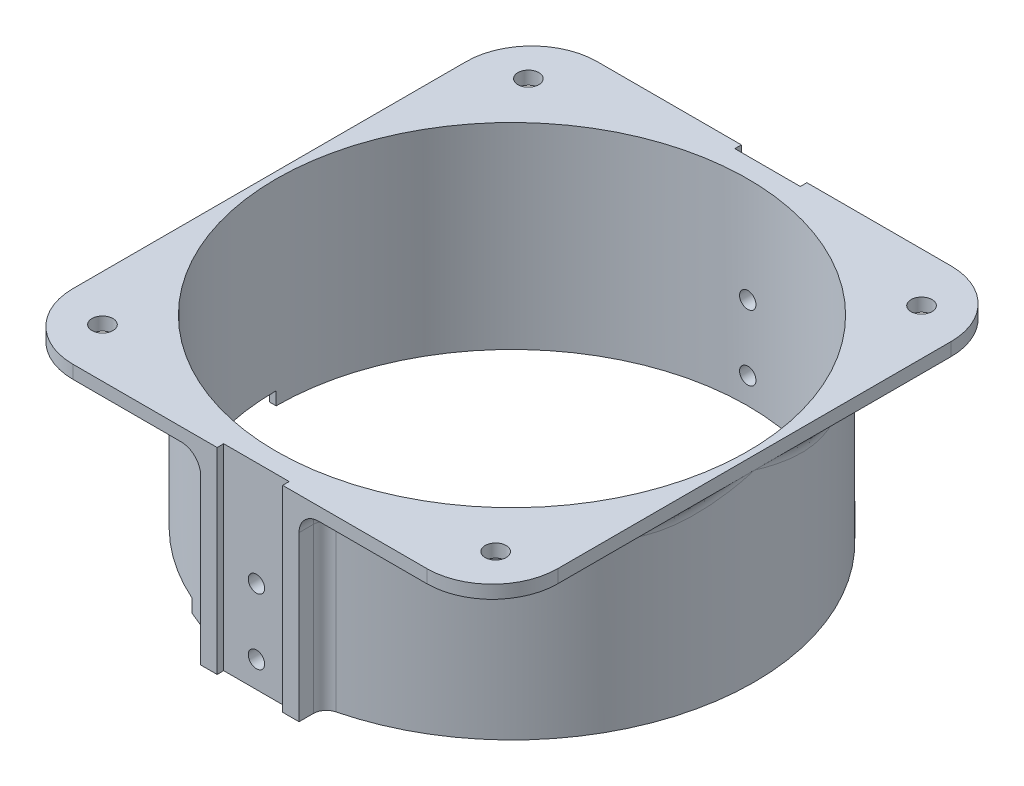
SolidWorks part; units mm, degrees
ref_plane "前视基准面" through (0, 0, 0) normal (0, 0, 1) x (1, 0, 0)
ref_plane "上视基准面" through (0, 0, 0) normal (0, 1, 0) x (1, 0, 0)
ref_plane "右视基准面" through (0, 0, 0) normal (1, 0, 0) x (0, 0, -1)
sketch "草图1" plane through (0, 0, 0) normal (0, 1, 0) x (1, 0, 0)
  circle A0 centre (0, 0) radius 36
  circle A1 centre (0, 0) radius 37
  dimension "D1" = 72
  dimension "D2" = 74
extrude "凸台-拉伸1" add sketch "草图1" along normal blind 30
sketch "草图2" plane through (0, 0, 0) normal (0, 1, 0) x (1, 0, 0)
  line L0 (-74.8137, 0) -> (0, 0) construction
  line L1 (0, 0) -> (0, -90.7206) construction
  line L3 (-37, 0) -> (-15, 0)
  line L4 (-37, 0) -> (-37, -40.3453)
  line L5 (-37, -40.3453) -> (-15, -40.3453)
  line L6 (-15, 0) -> (-15, -40.3453)
  circle A0 centre (0, 0) radius 37 construction
  dimension "D1" = 22
extrude "切除-拉伸1" cut sketch "草图2" along normal blind 2
sketch "草图3" plane through (0, 30, 0) normal (0, 1, 0) x (1, 0, 0)
  line L0 (0, -75.1314) -> (0, 57.0329) construction
  line L1 (57.2671, 0) -> (-67.0606, 0) construction
  line L2 (7.5, 40) -> (-7.5, 36.2319) construction
  line L3 (7.5, -40) -> (-7.5, -40)
  line L4 (7.5, -40) -> (7.5, -36.2319)
  line L5 (7.5, -36.2319) -> (-7.5, -36.2319)
  line L6 (-7.5, -40) -> (-7.5, -36.2319)
  line L7 (7.5, -40) -> (-7.5, -36.2319) construction
  line L8 (7.5, -36.2319) -> (-7.5, -40) construction
  line L9 (7.5, 40) -> (7.5, 36.2319)
  line L10 (7.5, 40) -> (-7.5, 40)
  line L11 (7.5, 36.2319) -> (-7.5, 40) construction
  line L12 (-7.5, 40) -> (-7.5, 36.2319)
  line L13 (7.5, 36.2319) -> (-7.5, 36.2319)
  circle A0 centre (0, 0) radius 37 construction
  point P5 (0, -38.1159)
  point P17 (0, 38.1159)
  dimension "D1" = 80
  dimension "D2" = 15
extrude "凸台-拉伸2" add sketch "草图3" against normal up to surface (30 mm away)
sketch "草图4" plane through (0, 30, 0) normal (0, 1, 0) x (1, 0, 0)
  line L0 (0, -71.6557) -> (0, 76.2439) construction
  line L1 (77.9233, 0) -> (-76.0365, 0) construction
  line L2 (7.5, 40) -> (-7.5, 40) construction
  line L3 (5, 39) -> (-5, 39)
  line L4 (5, 39) -> (5, 40)
  line L5 (5, 40) -> (-5, 40)
  line L6 (-5, 39) -> (-5, 40)
  line L7 (5, 39) -> (-5, 40) construction
  line L8 (5, 40) -> (-5, 39) construction
  line L9 (5, -40) -> (-5, -39) construction
  line L10 (5, -39) -> (-5, -40) construction
  line L11 (-5, -39) -> (-5, -40)
  line L12 (5, -40) -> (-5, -40)
  line L13 (5, -39) -> (5, -40)
  line L14 (5, -39) -> (-5, -39)
  point P5 (0, 39.5)
  point P16 (0, -39.5)
  dimension "D1" = 1
  dimension "D2" = 10
extrude "切除-拉伸2" cut sketch "草图4" against normal through all
fillet "圆角1" radius 2 4 edges at (-7.5, 15, 36.2319) (7.5, 15, 36.2319) (-7.5, 15, -36.2319) (7.5, 15, -36.2319)
sketch "草图5" plane through (0, 0, -39) normal (0, 0, -1) x (-1, 0, 0)
  line L0 (0, 22.5027) -> (0, -7.2445) construction
  line L1 (5, 0) -> (-5, 0) construction
  circle A0 centre (0, 4) radius 1.25
  circle A1 centre (0, 14) radius 1.25
  dimension "D1" = 2.5
  dimension "D2" = 4
  dimension "D3" = 10
extrude "切除-拉伸3" cut sketch "草图5" against normal through all
ref_plane "基准面1" through (0, 30, 0) normal (0, 1, 0) x (1, 0, 0)
sketch "草图6" plane through (0, 30, 0) normal (0, 1, 0) x (1, 0, 0)
  line L0 (-5, 40) -> (-7.5, 40) construction
  line L1 (37, -40) -> (-37, -40)
  line L2 (37, -40) -> (37, 40)
  line L3 (37, 40) -> (-37, 40)
  line L4 (-37, -40) -> (-37, 40)
  line L5 (37, -40) -> (-37, 40) construction
  line L6 (37, 40) -> (-37, -40) construction
  line L21 (5, -39) -> (5, -40)
  line L22 (5, -40) -> (7.5, -40)
  line L23 (7.5, -40) -> (7.5, -37.8253)
  line L24 (7.5, 37.8253) -> (7.5, 40)
  line L25 (7.5, 40) -> (5, 40)
  line L26 (5, 40) -> (5, 39)
  line L27 (5, 39) -> (-5, 39)
  line L28 (-5, 39) -> (-5, 40)
  line L29 (-5, 40) -> (-7.5, 40)
  line L30 (-7.5, 40) -> (-7.5, 37.8253)
  line L31 (-7.5, -37.8253) -> (-7.5, -40)
  line L32 (-7.5, -40) -> (-5, -40)
  line L33 (-5, -40) -> (-5, -39)
  line L34 (-5, -39) -> (5, -39)
  line L35 (5, -39) -> (5, -40)
  line L36 (5, -40) -> (7.5, -40)
  line L37 (7.5, -40) -> (7.5, -37.8253)
  line L38 (7.5, 37.8253) -> (7.5, 40)
  line L39 (7.5, 40) -> (5, 40)
  line L40 (5, 40) -> (5, 39)
  line L41 (5, 39) -> (-5, 39)
  line L42 (-5, 39) -> (-5, 40)
  line L43 (-5, 40) -> (-7.5, 40)
  line L44 (-7.5, 40) -> (-7.5, 37.8253)
  line L45 (-7.5, -37.8253) -> (-7.5, -40)
  line L46 (-7.5, -40) -> (-5, -40)
  line L47 (-5, -40) -> (-5, -39)
  line L48 (-5, -39) -> (5, -39)
  arc A0 (-9.0128, 35.8855) -> (-9.0128, -35.8855) centre (0, 0) ccw construction
  arc A7 (9.0128, -35.8855) -> (7.5, -37.8253) centre (9.5, -37.8253) ccw
  arc A8 (9.0128, -35.8855) -> (9.0128, 35.8855) centre (0, 0) ccw
  arc A9 (7.5, 37.8253) -> (9.0128, 35.8855) centre (9.5, 37.8253) ccw
  arc A10 (-9.0128, 35.8855) -> (-7.5, 37.8253) centre (-9.5, 37.8253) ccw
  arc A11 (-9.0128, 35.8855) -> (-9.0128, -35.8855) centre (0, 0) ccw
  arc A12 (-7.5, -37.8253) -> (-9.0128, -35.8855) centre (-9.5, -37.8253) ccw
  arc A13 (9.0128, -35.8855) -> (7.5, -37.8253) centre (9.5, -37.8253) ccw
  arc A14 (9.0128, -35.8855) -> (9.0128, 35.8855) centre (0, 0) ccw
  arc A15 (7.5, 37.8253) -> (9.0128, 35.8855) centre (9.5, 37.8253) ccw
  arc A16 (-9.0128, 35.8855) -> (-7.5, 37.8253) centre (-9.5, 37.8253) ccw
  arc A17 (-9.0128, 35.8855) -> (-9.0128, -35.8855) centre (0, 0) ccw
  arc A18 (-7.5, -37.8253) -> (-9.0128, -35.8855) centre (-9.5, -37.8253) ccw
  point P0 (0, 0)
  dimension "D1" = 0
extrude "凸台-拉伸3" add sketch "草图6" against normal blind 2 contours L4 L3 M37 M36 M35 | L2 L3 M29 M28 M27 | L1 L2 M27 M26 M25 | L4 L1 M39 M38 M37
fillet "圆角2" radius 10 4 edges at (-37, 29, 40) (37, 29, 40) (37, 29, -40) (-37, 29, -40)
sketch "草图7" plane through (0, 30, 0) normal (0, 1, 0) x (1, 0, 0)
  line L0 (0, 64.1626) -> (0, -66.2253) construction
  line L1 (-55.2969, 0) -> (65.2681, 0) construction
  circle A0 centre (-30, 32.5) radius 1.6
  circle A1 centre (30, 32.5) radius 1.6
  circle A2 centre (30, -32.5) radius 1.6
  circle A3 centre (-30, -32.5) radius 1.6
  dimension "D1" = 3.2
  dimension "D2" = 60
  dimension "D3" = 65
extrude "切除-拉伸4" cut sketch "草图7" against normal through all
fillet "圆角3" radius 3 12 edges at (-7.5, 28, -38.9126) (-7.9229, 28, -36.5953) (-29.176, 28, -22.7544) (-7.5, 28, 38.9126) (-7.9229, 28, 36.5953) (7.5, 28, 38.9126) (7.9229, 28, 36.5953) (7.5, 28, -38.9126) (7.9229, 28, -36.5953) (29.176, 28, -22.7544) (-29.176, 28, 22.7544) (29.176, 28, 22.7544)
sketch "草图8" plane through (0, 30, 0) normal (0, 1, 0) x (1, 0, 0)
  line L0 (0, 0) -> (58.3939, 0) construction
  line L1 (37, -30) -> (37, 30) construction
  line L2 (-37, -30) -> (-37, 30) construction
  line L3 (-37, -30) -> (-37, 30)
  line L4 (0, 0) -> (0, 20.324) construction
  line L5 (37, -30) -> (37, 30)
  arc A0 (-37, 30) -> (-37, -30) centre (58.3939, 0) ccw
  arc A1 (37, 30) -> (37, -30) centre (-58.3939, 0) cw
  dimension "D1" = 200
extrude "凸台-拉伸6" [suppressed] add sketch "草图8" against normal blind 1
